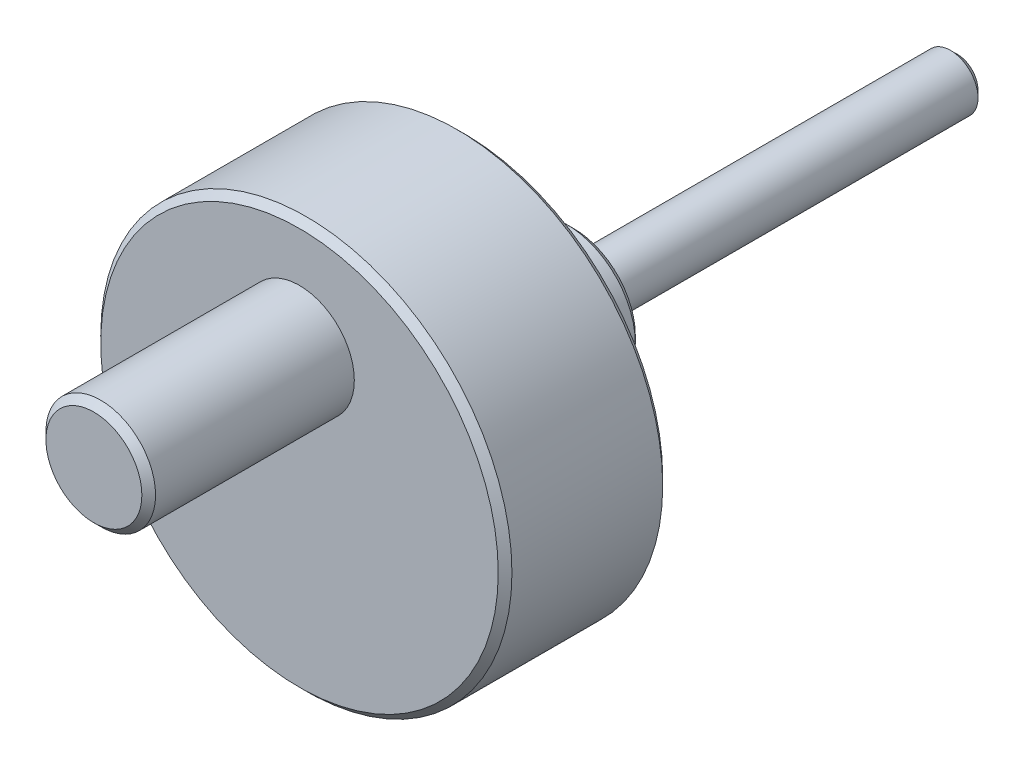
SolidWorks part; units mm, degrees
ref_plane "Front" through (0, 0, 0) normal (0, 0, 1) x (1, 0, 0)
ref_plane "Top" through (0, 0, 0) normal (0, 1, 0) x (1, 0, 0)
ref_plane "Right" through (0, 0, 0) normal (1, 0, 0) x (0, 0, -1)
sketch "Esquisse1" plane through (0, 0, 0) normal (0, 0, 1) x (1, 0, 0)
  circle A0 centre (0, 0) radius 1
  dimension "D1" = 2
extrude "Boss.-Extru.1" add sketch "Esquisse1" along normal blind 14
sketch "Esquisse2" plane through (0, 0, 14) normal (0, 0, 1) x (1, 0, 0)
  circle A0 centre (0, 0) radius 2.5
  dimension "D1" = 5
extrude "Boss.-Extru.2" add sketch "Esquisse2" along normal blind 4
sketch "Esquisse3" plane through (0, 0, 18) normal (0, 0, 1) x (1, 0, 0)
  circle A0 centre (0, 0) radius 7.5
  dimension "D1" = 15
extrude "Boss.-Extru.3" add sketch "Esquisse3" along normal blind 6
sketch "Esquisse4" plane through (0, 0, 24) normal (0, 0, 1) x (1, 0, 0)
  line L0 (0, 0) -> (0, 3.45) construction
  circle A0 centre (0, 3.45) radius 2
  dimension "D1" = 4
  dimension "D2" = 3.45
extrude "Boss.-Extru.4" add sketch "Esquisse4" along normal blind 7.5
chamfer "Chanfrein1" distance 0.25 angle 45 5 edges at (1, 0, 0) (2, 3.45, 31.5) (7.5, 0, 24) (7.5, 0, 18) (2.5, 0, 14)
sketch "Esquisse5" plane through (0, 0, 11) normal (0, 0, 1) x (1, 0, 0)
  line L0 (0, 3.45) -> (0, 0) construction
  point P0 (0, 3.45)
sketch "Esquisse6" plane through (0, 0, 24) normal (0, 0, 1) x (1, 0, 0)
  point P0 (0, 0)
